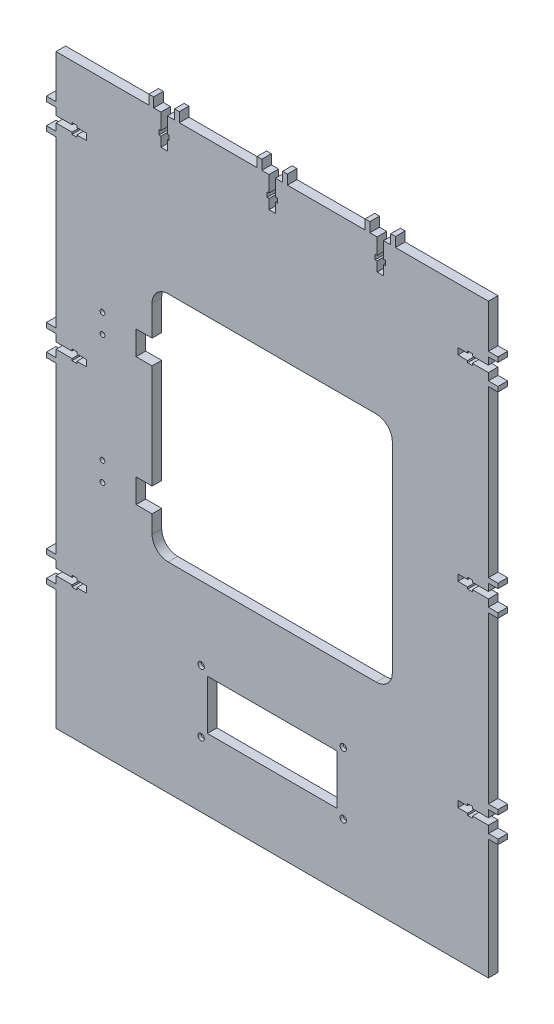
SolidWorks part; units mm, degrees
ref_plane "Front Plane" through (0, 0, 0) normal (0, 0, 1) x (1, 0, 0)
ref_plane "Top Plane" through (0, 0, 0) normal (0, 1, 0) x (1, 0, 0)
ref_plane "Right Plane" through (0, 0, 0) normal (1, 0, 0) x (0, 0, -1)
sketch "Sketch1" plane through (0, 0, 0) normal (0, 0, 1) x (1, 0, 0)
  line L1 (135, -183) -> (-135, -183)
  line L2 (135, -183) -> (135, 183)
  line L3 (135, 183) -> (-135, 183)
  line L4 (-135, -183) -> (-135, 183)
  line L5 (135, -183) -> (-135, 183) construction
  line L6 (135, 183) -> (-135, -183) construction
  point P0 (0, 0)
extrude "Boss-Extrude1" add sketch "Sketch1" along normal blind 6
sketch "Sketch2" plane through (0, 0, 6) normal (0, 0, 1) x (1, 0, 0)
  line L0 (-135, -83) -> (135, -83) construction
  line L1 (-135, 183) -> (-135, -183) construction
  line L2 (135, -183) -> (135, 183) construction
  line L3 (-135, -183) -> (135, -183) construction
  line L4 (-135, 117) -> (135, 117) construction
  line L5 (135, 183) -> (-135, 183) construction
  line L6 (135, -183) -> (135, 183) construction
  line L7 (-65, 87) -> (65, 87)
  line L8 (-75, 77) -> (-75, -48)
  line L9 (-65, -58) -> (65, -58)
  line L10 (75, 77) -> (75, -48)
  line L11 (-135, 183) -> (-135, -183) construction
  line L12 (0, 0) -> (0, 87) construction
  arc A0 (-75, -48) -> (-65, -58) centre (-65, -48) ccw
  arc A1 (65, -58) -> (75, -48) centre (65, -48) ccw
  arc A2 (65, 87) -> (75, 77) centre (65, 77) cw
  arc A3 (-65, 87) -> (-75, 77) centre (-65, 77) ccw
  dimension "D4" = 10
  dimension "D1" = 100
  dimension "D2" = 200
  dimension "D3" = 66
  dimension "D5" = 145
  dimension "D6" = 150
  dimension "D7" = 270
  dimension "D8" = 25
extrude "Cut-Extrude1" cut sketch "Sketch2" against normal up to next
sketch "Sketch4" plane through (0, 0, 0) normal (0, 0, -1) x (-1, 0, 0)
  line L0 (-50, -170) -> (50, -170) construction
  line L1 (-50, -163.65) -> (50, -163.65)
  line L2 (-50, -176.35) -> (50, -176.35)
  line L3 (0, -170) -> (0, 0) construction
  arc A0 (-50, -163.65) -> (-50, -176.35) centre (-50, -170) ccw
  arc A1 (50, -176.35) -> (50, -163.65) centre (50, -170) ccw
  point P2 (0, -170)
  dimension "D1" = 12.7
  dimension "D2" = 100
  dimension "D3" = 170
extrude "Cut-Extrude3" [suppressed] cut sketch "Sketch4" against normal blind 4
sketch "Sketch5" plane through (0, 0, 6) normal (0, 0, 1) x (1, 0, 0)
  line L0 (0, 0) -> (0, -98) construction
  line L1 (-50, -98) -> (50, -98) construction
  line L2 (-50, -98) -> (-50, -148) construction
  line L3 (-50, -148) -> (50, -148) construction
  line L4 (50, -98) -> (50, -148) construction
  line L5 (-65, -58) -> (65, -58) construction
  line L6 (-50, -98) -> (50, -148) construction
  line L8 (-40.5, -138.5) -> (40.5, -138.5)
  line L9 (-40.5, -138.5) -> (-40.5, -107.5)
  line L10 (-40.5, -107.5) -> (40.5, -107.5)
  line L11 (40.5, -138.5) -> (40.5, -107.5)
  line L12 (-40.5, -138.5) -> (40.5, -107.5) construction
  line L13 (-40.5, -107.5) -> (40.5, -138.5) construction
  line L14 (44.375, -142.375) -> (-44.375, -142.375) construction
  line L15 (44.375, -142.375) -> (44.375, -103.625) construction
  line L16 (44.375, -103.625) -> (-44.375, -103.625) construction
  line L17 (-44.375, -142.375) -> (-44.375, -103.625) construction
  line L18 (44.375, -142.375) -> (-44.375, -103.625) construction
  line L19 (44.375, -103.625) -> (-44.375, -142.375) construction
  circle A0 centre (-44.375, -103.625) radius 2
  circle A1 centre (44.375, -103.625) radius 2
  circle A2 centre (44.375, -142.375) radius 2
  circle A3 centre (-44.375, -142.375) radius 2
  point P9 (0, -123)
  point P14 (0, -123)
  dimension "D8" = 4
  dimension "D1" = 100
  dimension "D2" = 50
  dimension "D3" = 40
  dimension "D4" = 81
  dimension "D5" = 31
  dimension "D6" = 88.75
  dimension "D7" = 38.75
extrude "Cut-Extrude4" cut sketch "Sketch5" against normal through all
sketch "Sketch6" plane through (0, 0, 0) normal (0, 0, -1) x (-1, 0, 0)
  line L1 (-40.875, -101.6043) -> (-44.375, -99.5835)
  line L2 (-44.375, -99.5835) -> (-47.875, -101.6043)
  line L3 (-47.875, -101.6043) -> (-47.875, -105.6457)
  line L4 (-47.875, -105.6457) -> (-44.375, -107.6665)
  line L5 (-44.375, -107.6665) -> (-40.875, -105.6457)
  line L6 (-40.875, -105.6457) -> (-40.875, -101.6043)
  line L7 (40.875, -101.6043) -> (40.875, -105.6457)
  line L8 (40.875, -105.6457) -> (44.375, -107.6665)
  line L9 (44.375, -107.6665) -> (47.875, -105.6457)
  line L10 (47.875, -105.6457) -> (47.875, -101.6043)
  line L11 (47.875, -101.6043) -> (44.375, -99.5835)
  line L12 (44.375, -99.5835) -> (40.875, -101.6043)
  line L13 (47.875, -140.3543) -> (44.375, -138.3335)
  line L14 (44.375, -138.3335) -> (40.875, -140.3543)
  line L15 (40.875, -140.3543) -> (40.875, -144.3957)
  line L16 (40.875, -144.3957) -> (44.375, -146.4165)
  line L17 (44.375, -146.4165) -> (47.875, -144.3957)
  line L18 (47.875, -144.3957) -> (47.875, -140.3543)
  line L19 (-40.875, -144.3957) -> (-40.875, -140.3543)
  line L20 (-40.875, -140.3543) -> (-44.375, -138.3335)
  line L21 (-44.375, -138.3335) -> (-47.875, -140.3543)
  line L22 (-47.875, -140.3543) -> (-47.875, -144.3957)
  line L23 (-47.875, -144.3957) -> (-44.375, -146.4165)
  line L24 (-44.375, -146.4165) -> (-40.875, -144.3957)
  circle A0 centre (-44.375, -103.625) radius 3.5 construction
  circle A1 centre (44.375, -103.625) radius 3.5 construction
  circle A2 centre (44.375, -142.375) radius 3.5 construction
  circle A3 centre (-44.375, -142.375) radius 3.5 construction
  dimension "D1" = 7
extrude "Cut-Extrude5" cut sketch "Sketch6" against normal blind 4
sketch "Sketch7" plane through (0, 0, 6) normal (0, 0, 1) x (1, 0, 0)
  line L0 (-69.5, 183) -> (-65.5, 183)
  line L1 (135, 183) -> (-135, 183) construction
  line L2 (-65.5, 183) -> (-65.5, 173)
  line L3 (-65.5, 173) -> (-64.3, 173)
  line L4 (-64.3, 173) -> (-64.3, 170)
  line L5 (-64.3, 170) -> (-65.5, 170)
  line L6 (-65.5, 170) -> (-65.5, 164)
  line L7 (-65.5, 164) -> (-69.5, 164)
  line L8 (-69.5, 164) -> (-69.5, 170)
  line L9 (-69.5, 170) -> (-70.7, 170)
  line L10 (-70.7, 170) -> (-70.7, 173)
  line L11 (-70.7, 173) -> (-69.5, 173)
  line L12 (-69.5, 173) -> (-69.5, 183)
  line L13 (-67.5, 183) -> (-67.5, 164) construction
  line L14 (-135, 183) -> (-135, -183) construction
  dimension "D1" = 4
  dimension "D2" = 10
  dimension "D3" = 3
  dimension "D4" = 6
  dimension "D5" = 6.4
  dimension "D6" = 67.5
extrude "Cut-Extrude6" cut sketch "Sketch7" against normal blind 10
sketch "Sketch8" plane through (0, 0, 6) normal (0, 0, 1) x (1, 0, 0)
  line L0 (-69.5, 183) -> (-135, 183) construction
  line L1 (-77, 183) -> (-74, 183)
  line L2 (-77, 183) -> (-77, 189)
  line L3 (-77, 189) -> (-74, 189)
  line L4 (-74, 183) -> (-74, 189)
  line L5 (-69.5, 164) -> (-65.5, 164) construction
  line L6 (-67.5, 164) -> (-67.5, 183) construction
  line L7 (-67.5, 183) -> (-69.5, 183) construction
  line L8 (-58, 189) -> (-61, 189)
  line L9 (-61, 183) -> (-61, 189)
  line L10 (-58, 183) -> (-61, 183)
  line L11 (-58, 183) -> (-58, 189)
  point P6 (-75.5, 189)
  point P9 (-67.5, 164)
  dimension "D1" = 3
  dimension "D2" = 6
  dimension "D3" = 8
extrude "Boss-Extrude2" add sketch "Sketch8" against normal through all contours L2 L1 L4 L3 | L8 L9 L10 L11
pattern_linear "LPattern1" count 3 spacing 67.5 along (1, 0, 0) of "Cut-Extrude6", "Boss-Extrude2"
sketch "Sketch9" plane through (0, 0, 6) normal (0, 0, 1) x (1, 0, 0)
  line L0 (-135, 148.4) -> (-125, 148.4)
  line L1 (-135, 183) -> (-135, -183) construction
  line L2 (-125, 148.4) -> (-125, 149.6)
  line L3 (-125, 149.6) -> (-122, 149.6)
  line L4 (-122, 149.6) -> (-122, 148.4)
  line L5 (-122, 148.4) -> (-116, 148.4)
  line L6 (-116, 148.4) -> (-116, 144.4)
  line L7 (-116, 144.4) -> (-122, 144.4)
  line L8 (-122, 144.4) -> (-122, 143.2)
  line L9 (-122, 143.2) -> (-125, 143.2)
  line L10 (-125, 143.2) -> (-125, 144.4)
  line L11 (-125, 144.4) -> (-135, 144.4)
  line L12 (-135, 144.4) -> (-135, 148.4)
  line L13 (-135, 183) -> (-135, -183) construction
  line L14 (-77, 183) -> (-135, 183) construction
  point P16 (-135, 146.4)
extrude "Cut-Extrude7" cut sketch "Sketch9" against normal through all
sketch "Sketch10" plane through (0, 0, 6) normal (0, 0, 1) x (1, 0, 0)
  line L0 (-135, 183) -> (-135, 148.4) construction
  line L1 (-135, 155.9) -> (-141, 155.9)
  line L2 (-135, 155.9) -> (-135, 152.9)
  line L3 (-135, 152.9) -> (-141, 152.9)
  line L4 (-141, 155.9) -> (-141, 152.9)
  line L5 (-116, 144.4) -> (-116, 148.4) construction
  line L6 (-116, 146.4) -> (-135, 146.4) construction
  line L7 (-135, 146.4) -> (-135, 148.4) construction
  line L8 (-135, 139.9) -> (-141, 139.9)
  line L9 (-141, 136.9) -> (-141, 139.9)
  line L10 (-135, 136.9) -> (-141, 136.9)
  line L11 (-135, 136.9) -> (-135, 139.9)
  point P6 (-135, 154.4)
  point P9 (-116, 146.4)
  dimension "D1" = 3
  dimension "D2" = 6
  dimension "D3" = 8
extrude "Boss-Extrude4" add sketch "Sketch10" against normal through all
pattern_linear "LPattern2" count 3 spacing 122.4 along (0, -1, 0) of "Cut-Extrude7", "Boss-Extrude4"
mirror "Mirror1" about plane through (0, 0, 0) normal (1, 0, 0) of "LPattern2", "Cut-Extrude7", "Boss-Extrude4"
sketch "Sketch12" plane through (0, 0, 0) normal (0, 0, -1) x (-1, 0, 0)
  line L0 (135, -183) -> (-135, -183) construction
  line L1 (75, -48) -> (75, 77) construction
  line L2 (106, 56.5) -> (106, 44.5) construction
  line L3 (106, 56.5) -> (106, -23.5) construction
  circle A0 centre (106, 56.5) radius 1.5
  circle A1 centre (106, 44.5) radius 1.5
  circle A2 centre (106, -23.5) radius 1.5
  circle A3 centre (106, -35.5) radius 1.5
  dimension "D1" = 239.5
  dimension "D2" = 3
  dimension "D3" = 31
  dimension "D5" = 12
  dimension "D7" = 80
  dimension "D4" = 2
  dimension "D6" = 2
extrude "Cut-Extrude8" cut sketch "Sketch12" against normal through all
sketch "Sketch13" plane through (0, 0, 0) normal (0, 0, -1) x (-1, 0, 0)
  line L1 (107.5911, 53.7441) -> (109.1822, 56.5)
  line L2 (109.1822, 56.5) -> (107.5911, 59.2559)
  line L3 (107.5911, 59.2559) -> (104.4089, 59.2559)
  line L4 (104.4089, 59.2559) -> (102.8178, 56.5)
  line L5 (102.8178, 56.5) -> (104.4089, 53.7441)
  line L6 (104.4089, 53.7441) -> (107.5911, 53.7441)
  line L7 (109.1822, 44.5) -> (107.5911, 47.2559)
  line L8 (107.5911, 47.2559) -> (104.4089, 47.2559)
  line L9 (104.4089, 47.2559) -> (102.8178, 44.5)
  line L10 (102.8178, 44.5) -> (104.4089, 41.7441)
  line L11 (104.4089, 41.7441) -> (107.5911, 41.7441)
  line L12 (107.5911, 41.7441) -> (109.1822, 44.5)
  line L13 (107.5911, -20.7441) -> (104.4089, -20.7441)
  line L14 (104.4089, -20.7441) -> (102.8178, -23.5)
  line L15 (102.8178, -23.5) -> (104.4089, -26.2559)
  line L16 (104.4089, -26.2559) -> (107.5911, -26.2559)
  line L17 (107.5911, -26.2559) -> (109.1822, -23.5)
  line L18 (109.1822, -23.5) -> (107.5911, -20.7441)
  line L19 (109.1822, -35.5) -> (107.5911, -32.7441)
  line L20 (107.5911, -32.7441) -> (104.4089, -32.7441)
  line L21 (104.4089, -32.7441) -> (102.8178, -35.5)
  line L22 (102.8178, -35.5) -> (104.4089, -38.2559)
  line L23 (104.4089, -38.2559) -> (107.5911, -38.2559)
  line L24 (107.5911, -38.2559) -> (109.1822, -35.5)
  circle A0 centre (106, 56.5) radius 2.7559 construction
  circle A1 centre (106, 44.5) radius 2.7559 construction
  circle A2 centre (106, -23.5) radius 2.7559 construction
  circle A3 centre (106, -35.5) radius 2.7559 construction
  dimension "D1" = 5.5118
extrude "Cut-Extrude9" cut sketch "Sketch13" against normal blind 4
sketch "Sketch14" plane through (0, 0, 6) normal (0, 0, 1) x (1, 0, 0)
  line L0 (-75, 77) -> (-75, -48) construction
  line L1 (-75, 58) -> (-85, 58)
  line L2 (-75, 58) -> (-75, 43)
  line L3 (-75, 43) -> (-85, 43)
  line L4 (-85, 58) -> (-85, 43)
  line L5 (-106, 56.5) -> (-106, 44.5) construction
  line L6 (-75, -22) -> (-85, -22)
  line L7 (-75, -22) -> (-75, -37)
  line L8 (-75, -37) -> (-85, -37)
  line L9 (-85, -22) -> (-85, -37)
  line L10 (-106, 44.5) -> (-106, 58) construction
  line L11 (-106, 58) -> (-106, 43) construction
  line L12 (-106, -23.5) -> (-106, -35.5) construction
  line L13 (-85, -29.5) -> (-106, -29.5) construction
  line L14 (-106, 50.5) -> (-85, 50.5) construction
  circle A0 centre (-106, 56.5) radius 1.5 construction
  circle A1 centre (-106, 44.5) radius 1.5 construction
  dimension "D1" = 15
  dimension "D2" = 10
extrude "Cut-Extrude10" cut sketch "Sketch14" against normal up to next
equation "\"D7@Sketch9\"=(\"D6@Sketch9\"/5)/2"
equation "\"D2@Sketch1\"=366.00mm"
